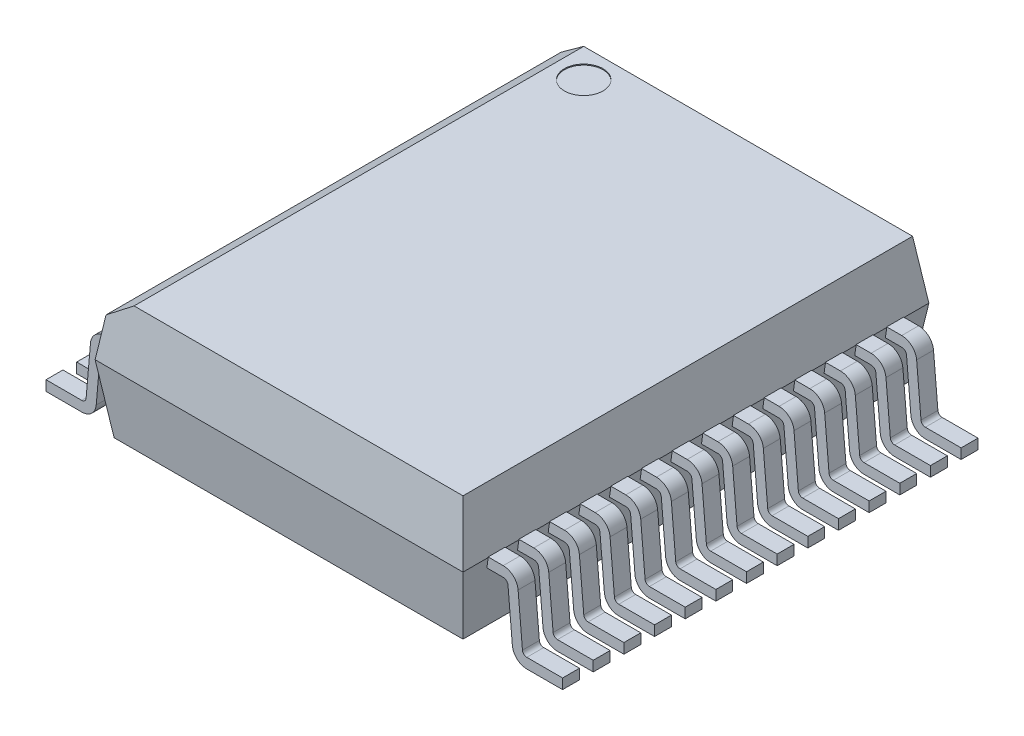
SolidWorks part; units mm, degrees
ref_plane "Front" through (0, 0, 0) normal (0, 0, 1) x (1, 0, 0)
ref_plane "Top" through (0, 0, 0) normal (0, 1, 0) x (1, 0, 0)
ref_plane "Right" through (0, 0, 0) normal (1, 0, 0) x (0, 0, -1)
ref_plane "ПлоскостьВывод1" through (0, 0, -4.1275) normal (0, 0, 1) x (1, 0, 0)
sketch "ЭскизВывод1" plane through (0, 0, -4.1275) normal (0, 0, 1) x (1, 0, 0)
  line L0 (-5.35, 0) -> (-4.6089, 0)
  line L1 (-4.31, 0.2739) -> (-4.2195, 1.3087)
  line L2 (-4.1199, 1.4) -> (4.1199, 1.4)
  line L3 (0, 1.4) -> (0, 0) construction
  line L4 (4.31, 0.2739) -> (4.2195, 1.3087)
  line L5 (5.35, 0) -> (4.6089, 0)
  arc A0 (-4.2195, 1.3087) -> (-4.1199, 1.4) centre (-4.1199, 1.3) cw
  arc A1 (-4.6089, 0) -> (-4.31, 0.2739) centre (-4.6089, 0.3) ccw
  arc A2 (4.6089, 0) -> (4.31, 0.2739) centre (4.6089, 0.3) cw
  arc A3 (4.2195, 1.3087) -> (4.1199, 1.4) centre (4.1199, 1.3) ccw
  point P8 (-4.2115, 1.4)
  point P11 (-4.334, 0)
  dimension "D6" = 0.1
  dimension "D7" = 0.3
  dimension "E" = 10.7
  dimension "A_mid_lead" = 1.4
  dimension "L" = 1.016
  dimension "D4" = 85
  dimension "D5" = 8.423
extrude "Вывод1" add sketch "ЭскизВывод1" along normal mid plane 0.35 thin
ref_plane "ПлоскостьКорпус" through (0, 1.6, 0) normal (0, 1, 0) x (-1, 0, 0)
sketch "ЭскизКорпус" plane through (0, 1.6, 0) normal (0, 1, 0) x (1, 0, 0)
  line L1 (3.81, -4.825) -> (-3.81, -4.825)
  line L2 (3.81, -4.825) -> (3.81, 4.825)
  line L3 (3.81, 4.825) -> (-3.81, 4.825)
  line L4 (-3.81, -4.825) -> (-3.81, 4.825)
  line L5 (3.81, -4.825) -> (-3.81, 4.825) construction
  line L6 (3.81, 4.825) -> (-3.81, -4.825) construction
  point P0 (0, 0)
  dimension "D" = 9.65
  dimension "E" = 7.62
extrude "Корпус" add sketch "ЭскизКорпус" along normal offset from surface 2.8 draft 8 and the other way offset from surface (1.4 mm away) 0.2 draft 8
pattern_linear "Выводы" count 14 spacing 0.635 along (0, 0, 1) of "Вывод1"
chamfer "Фаска1" distance 0.4 angle 45 1 edges at (-3.6414, 2.8, 0)
sketch "Эскиз3" plane through (0, 2.8, 0) normal (0, 1, 0) x (1, 0, 0)
  line L0 (-3.1714, 4.0564) -> (-2.5714, 4.0564) construction
  line L1 (-3.1714, 4.6564) -> (-3.1714, -4.6564) construction
  line L2 (-2.5714, 4.0564) -> (-2.5714, 4.6564) construction
  line L3 (3.6414, 4.6564) -> (-3.1714, 4.6564) construction
  circle A0 centre (-2.5714, 4.0564) radius 0.4
  dimension "D2" = 0.8
  dimension "D1" = 0.6
extrude "Вытянуть3" cut sketch "Эскиз3" against normal blind 0.02
sketch "SkThermalPad" plane through (0, 1.6, 0) normal (0, 1, 0) x (-1, 0, 0)
  line L1 (1.25, 1.25) -> (-1.25, 1.25)
  line L2 (1.25, 1.25) -> (1.25, -1.25)
  line L3 (1.25, -1.25) -> (-1.25, -1.25)
  line L4 (-1.25, 1.25) -> (-1.25, -1.25)
  line L5 (1.25, 1.25) -> (-1.25, -1.25) construction
  line L6 (1.25, -1.25) -> (-1.25, 1.25) construction
  point P0 (0, 0)
  dimension "D1" = 2.5
  dimension "E2" = 2.5
extrude "ThermalPad" [suppressed] add sketch "SkThermalPad" against normal up to surface (0.95 mm away)
